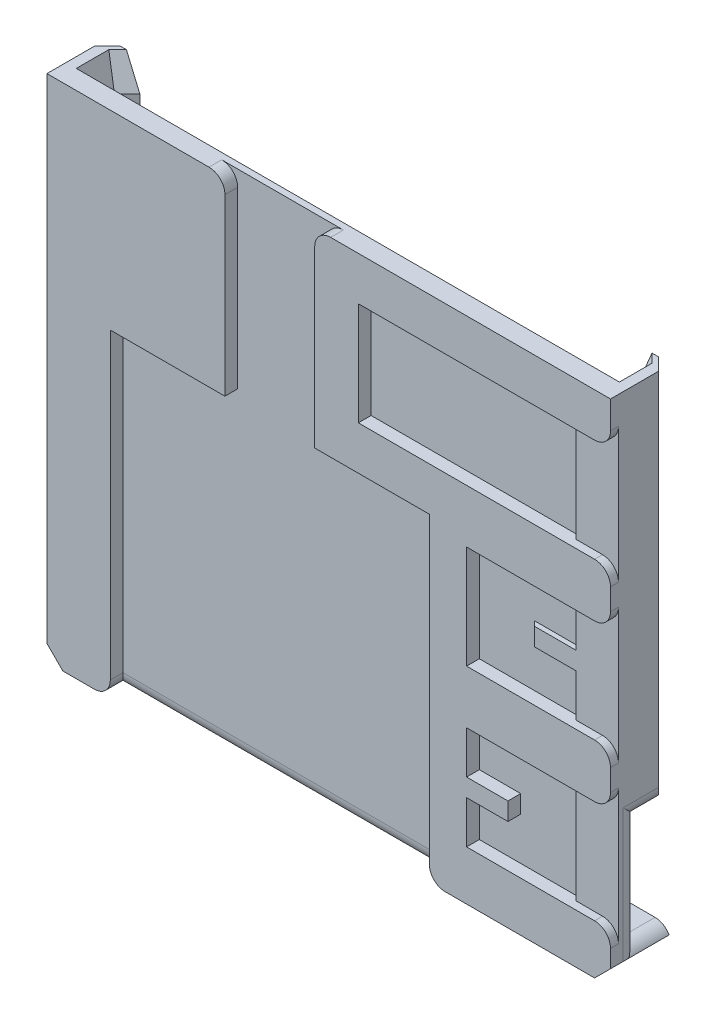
SolidWorks part; units mm, degrees
ref_plane "Ebene vorne" through (0, 0, 0) normal (0, 0, 1) x (1, 0, 0)
ref_plane "Ebene oben" through (0, 0, 0) normal (0, 1, 0) x (1, 0, 0)
ref_plane "Ebene rechts" through (0, 0, 0) normal (1, 0, 0) x (0, 0, -1)
sketch "Skizze1" plane through (0, 0, 0) normal (0, 0, 1) x (1, 0, 0)
  line L1 (-88.5, -80) -> (0, -80)
  line L2 (-88.5, -80) -> (-88.5, 80)
  line L3 (-88.5, 80) -> (0, 80)
  line L4 (0, -80) -> (0, 80)
  point P0 (0, 0)
extrude "Aufsatz-Linear austragen1" add sketch "Skizze1" along normal blind 5
sketch "Skizze2" plane through (0, 0, 5) normal (0, 0, 1) x (1, 0, 0)
  line L0 (0, 80) -> (-88.5, 80) construction
  line L2 (-88.5, -38.2) -> (-88.5, 80)
  line L6 (-82.3, -38.2) -> (-82.3, -32)
  line L7 (0, -80) -> (0, 80) construction
  line L8 (-88.5, 80) -> (-82.3, 80)
  line L9 (-82.3, -32) -> (0, -32)
  line L12 (-88.5, -38.2) -> (-82.3, -38.2)
  line L16 (0, -38.2) -> (-82.3, -38.2)
  line L17 (-82.3, 80) -> (-82.3, -32)
  line L18 (0, -38.2) -> (0, -32)
  line L19 (0, -32) -> (0, 80)
  line L20 (-82.3, -32) -> (-82.3, -38.2)
  line L21 (0, 80) -> (-88.5, 80) construction
  point P0 (0, 0)
  point P10 (0, 0)
  dimension "D1" = 6.2
  dimension "D2" = 112
extrude "Aufsatz-Linear austragen4" add sketch "Skizze2" against normal blind 11 contours L17 L12 L6 M6 M7 | L16 L9 L6 M5
sketch "Skizze4" plane through (0, 0, -6) normal (0, 0, -1) x (-1, 0, 0)
  line L0 (82.3, 80) -> (0, 80) construction
  line L5 (82.3, 80) -> (88.5, 80)
  line L6 (82.3, 80) -> (82.3, -32)
  line L7 (82.3, -32) -> (88.5, -32)
  line L8 (88.5, 80) -> (88.5, -32)
  line L10 (82.3, -32) -> (82.3, 80) construction
  line L12 (88.5, -38.2) -> (88.5, -80) construction
  line L13 (0, -32) -> (82.3, -32) construction
sketch "Skizze5" plane through (0, -32, 0) normal (0, 1, 0) x (-1, 0, 0)
  line L0 (82.3, -6) -> (78.3, -10)
  line L3 (82.3, -6) -> (0, -6) construction
  dimension "D1" = 4
  dimension "D2" = 45
sweep "Austragung1" add profiles "Skizze4" path "Skizze5"
sketch "Skizze6" plane through (0, -38.2, 0) normal (0, -1, 0) x (1, 0, 0)
  line L5 (-84.5, -10) -> (-88.5, -6)
  line L8 (-88.5, -6) -> (-88.5, 0)
  line L9 (-88.5, 0) -> (0, 0)
  line L10 (0, 0) -> (0, -10)
  line L11 (0, -10) -> (-84.5, -10)
  line L12 (-82.3, -6) -> (-88.5, -6) construction
  line L13 (-88.5, -6) -> (-84.5, -10) construction
  line L14 (-78.3, -10) -> (-84.5, -10) construction
extrude "Aufsatz-Linear austragen5" add sketch "Skizze6" against normal blind 6.5 contours L5 L8 L9 L10 L11
mirror "Spiegeln1" about plane through (0, -80, 5) normal (-1, 0, 0) of "Aufsatz-Linear austragen5", "Aufsatz-Linear austragen4", "Austragung1", "Aufsatz-Linear austragen1"
sketch "Skizze8" plane through (0, 0, 5) normal (0, 0, 1) x (1, 0, 0)
  line L8 (-18.5, 105.1902) -> (-18.5, -80) construction
  line L9 (9.3, 66.3) -> (9.3, 80) construction
  line L14 (88.5, -80) -> (88.5, 80) construction
  line L15 (43.5, 16.93) -> (43.5, -15.07)
  line L16 (43.5, -15.07) -> (73.5, -15.07)
  line L17 (73.5, -15.07) -> (73.5, -2.07)
  line L46 (43.5, -51.24) -> (43.5, -64.24)
  line L47 (43.5, -64.24) -> (73.5, -64.24)
  line L48 (73.5, -64.24) -> (73.5, -32.24)
  line L49 (73.5, -32.24) -> (43.5, -32.24)
  line L50 (43.5, -32.24) -> (43.5, -45.24)
  line L51 (43.5, -45.24) -> (56.5, -45.24)
  line L52 (56.5, -45.24) -> (56.5, -51.24)
  line L53 (56.5, -51.24) -> (43.5, -51.24)
  line L54 (73.5, -2.07) -> (60.5, -2.07)
  line L69 (60.5, -2.07) -> (60.5, 3.93)
  line L70 (60.5, 3.93) -> (73.5, 3.93)
  line L71 (73.5, 3.93) -> (73.5, 16.93)
  line L72 (73.5, 16.93) -> (43.5, 16.93)
  line L73 (73.7, 17.13) -> (43.3, 17.13)
  line L74 (43.3, 17.13) -> (43.3, -15.27)
  line L75 (43.3, -15.27) -> (73.7, -15.27)
  line L76 (73.7, -15.27) -> (73.7, -1.87)
  line L77 (73.7, -1.87) -> (60.7, -1.87)
  line L78 (60.7, -1.87) -> (60.7, 3.73)
  line L79 (60.7, 3.73) -> (73.7, 3.73)
  line L80 (73.7, 3.73) -> (73.7, 17.13)
  line L81 (43.3, -51.04) -> (43.3, -64.44)
  line L82 (43.3, -64.44) -> (73.7, -64.44)
  line L83 (73.7, -64.44) -> (73.7, -32.04)
  line L84 (73.7, -32.04) -> (43.3, -32.04)
  line L85 (43.3, -32.04) -> (43.3, -45.44)
  line L86 (43.3, -45.44) -> (56.3, -45.44)
  line L87 (56.3, -45.44) -> (56.3, -51.04)
  line L88 (56.3, -51.04) -> (43.3, -51.04)
  line L89 (-68.6, 20.2) -> (-32.6, 20.2)
  line L90 (-32.6, 20.2) -> (-32.6, 80)
  line L93 (-4.4, 80) -> (-4.4, 20.2)
  line L94 (-4.4, 20.2) -> (31.6, 20.2)
  line L105 (43.3, -80) -> (43.3, -64.44) construction
  line L107 (88.5, 80) -> (-88.5, 80) construction
  line L108 (-88.5, 80) -> (-32.6, 80)
  line L111 (9.3, 33.9) -> (73.7, 33.9)
  line L112 (9.3, 33.9) -> (9.3, 66.3)
  line L113 (9.3, 66.3) -> (73.7, 66.3)
  line L114 (73.7, 33.9) -> (73.7, 66.3)
  line L115 (9.3, 33.9) -> (73.7, 66.3) construction
  line L116 (9.3, 66.3) -> (73.7, 33.9) construction
  line L117 (-32.6, 20.2) -> (-18.5, 20.2) construction
  line L118 (88.5, 80) -> (88.5, -80) construction
  line L119 (-4.4, 80) -> (88.5, 80)
  line L120 (-18.5, 20.2) -> (-4.4, 20.2) construction
  line L122 (9.3, 66.3) -> (-4.4, 66.3) construction
  line L123 (-68.6, 20.2) -> (-68.6, -80)
  line L126 (-88.5, -80) -> (88.5, -80) construction
  line L127 (31.6, 20.2) -> (31.6, -80)
  line L128 (-18.5, -80) -> (31.6, -80)
  line L129 (31.6, -80) -> (88.5, -80)
  line L130 (88.5, -80) -> (88.5, 80)
  line L136 (-88.5, -80) -> (-88.5, 80)
  line L138 (-88.5, -80.5) -> (-88.5, -80)
  line L140 (-88.5, -80) -> (-68.6, -80)
  line L141 (9.3, 33.9) -> (9.3, 20.2) construction
  point P64 (41.5, 50.1)
  dimension "D3" = 100.2
  dimension "D4" = 100.2
  dimension "D5" = 32
  dimension "D6" = 49.17
  dimension "D7" = 49.17
  dimension "D8" = 13
  dimension "D9" = 13
  dimension "D10" = 13
  dimension "D11" = 15
  dimension "D12" = 17
  dimension "D13" = 30
  dimension "D14" = 19.9
  dimension "D15" = 13
  dimension "D16" = 13
  dimension "D17" = 30
  dimension "D18" = 13
  dimension "D23" = 64.4
  dimension "D24" = 32.4
  dimension "D19" = 0.2
extrude "Aufsatz-Linear austragen6" add sketch "Skizze8" along normal blind 4
sketch "Skizze11" plane through (0, 0, 9) normal (0, 0, 1) x (1, 0, 0)
  line L0 (73.7, 66.3) -> (88.5, 66.3)
  line L2 (73.7, 66.3) -> (73.7, 33.9)
  line L3 (73.7, 33.9) -> (88.5, 33.9)
  line L4 (88.5, 33.9) -> (88.5, 66.3)
  line L5 (73.7, 17.13) -> (73.7, 3.73)
  line L6 (73.7, 3.73) -> (60.7, 3.73)
  line L7 (60.7, 3.73) -> (60.7, -1.87)
  line L8 (60.7, -1.87) -> (73.7, -1.87)
  line L9 (73.7, -1.87) -> (73.7, -15.27)
  line L10 (73.7, -15.27) -> (88.5, -15.27)
  line L11 (88.5, -15.27) -> (88.5, 17.13)
  line L12 (88.5, 17.13) -> (73.7, 17.13)
  line L13 (73.7, -32.04) -> (73.7, -64.44)
  line L14 (73.7, -64.44) -> (88.5, -64.44)
  line L15 (88.5, -64.44) -> (88.5, -32.04)
  line L16 (88.5, -32.04) -> (73.7, -32.04)
  line L17 (9.3, 66.3) -> (73.7, 66.3) construction
  line L18 (9.3, 66.3) -> (73.7, 66.3) construction
  line L19 (73.7, 3.73) -> (73.7, 17.13) construction
  line L20 (73.7, 3.73) -> (73.7, 17.13) construction
  line L21 (73.7, 17.13) -> (43.3, 17.13) construction
  line L22 (88.5, -80) -> (88.5, 80) construction
extrude "Schnitt-Linear austragen2" cut sketch "Skizze11" against normal blind 2.5
chamfer "Fase2" distance 1.5 5 edges at (73.7, -48.24, 6.5) (73.7, -8.57, 6.5) (60.7, 0.93, 6.5) (73.7, 10.43, 6.5) (73.7, 50.1, 6.5)
sketch "Skizze12" plane through (88.5, 0, 0) normal (1, 0, 0) x (0, 0, -1)
  line L0 (0, -80) -> (10, -80)
  line L1 (10, -80) -> (10, -73)
  line L2 (10, -73) -> (0, -73)
  line L3 (0, -38.2) -> (0, -80) construction
  line L4 (0, -73) -> (0, -80)
  dimension "D1" = 7
  dimension "D2" = 10
extrude "Aufsatz-Linear austragen7" add sketch "Skizze12" against normal blind 177
chamfer "Fase3" distance 3 distance2 10 1 edges at (-82.3, 80, -3)
chamfer "Fase4" distance 10 distance2 3 6 edges at (-1.5, 80, 0) (82.3, 80, -3) (80.3, 80, -8) (-83.8, 75, 0) (-83.8, 75, -4.5) (-81.8, 80, -6.5)
fillet "Verrundung1" radius 5 19 edges at (88.5, -55.6, 0) (88.5, -38.2, -3) (-88.5, -55.6, 0) (86.5, -38.2, -8) (-18.5, -80, 5) (-68.6, -80, 7) (-32.6, 80, 7) (31.6, -80, 7) (-4.4, 80, 7) (-88.5, -38.2, -3) (88.5, 66.3, 7.75) (88.5, 33.9, 7.75) (88.5, 17.13, 7.75) (88.5, -15.27, 7.75) (88.5, -32.04, 7.75) (88.5, -64.44, 7.75) (-88.5, -73, -5) (88.5, -73, -5) (-86.5, -38.2, -8)
chamfer "Fase5" distance 5 angle 45 8 edges at (-88.5, -79, -10) (88.5, -79, -10) (88.5, -78, -2.5) (-88.5, -78, -2.5) (-87.0355, -74.4645, 1.4645) (87.0355, -74.4645, 1.4645) (-88.5, -80, -0.5) (88.5, -80, -0.5)
equation "\"a\"=5"
equation "\"b\"=45"
equation "\"Seite_1\"= 160"
equation "\"D2@Skizze1\"=\"Seite_1\""
equation "\"Seite_2\"= 88.5"
equation "\"D1@Skizze1\"=\"Seite_2\""
